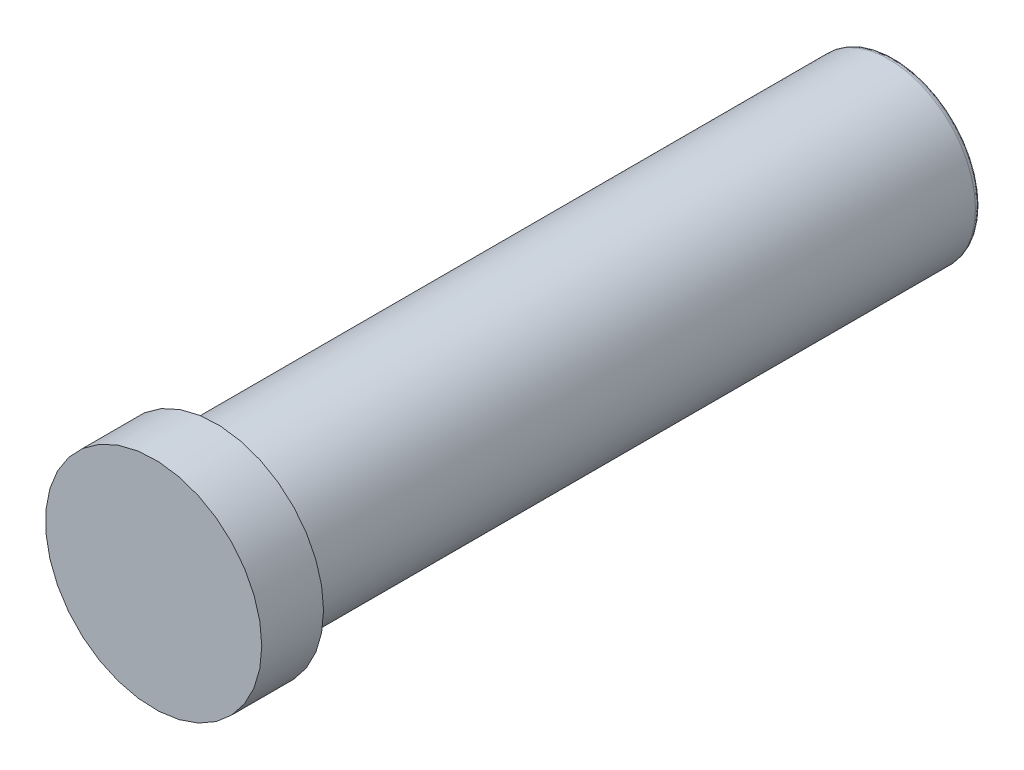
SolidWorks part; units mm, degrees
ref_plane "Front Plane" through (0, 0, 0) normal (0, 0, 1) x (1, 0, 0)
ref_plane "Top Plane" through (0, 0, 0) normal (0, 1, 0) x (1, 0, 0)
ref_plane "Right Plane" through (0, 0, 0) normal (1, 0, 0) x (0, 0, -1)
sketch "Sketch1" plane through (0, 0, 0) normal (1, 0, 0) x (0, 0, -1)
  line L0 (0, 0) -> (125, 0) construction
  line L1 (125, 0) -> (125, 13)
  line L2 (124, 14) -> (10, 14)
  line L3 (10, 14) -> (10, 17.5)
  line L4 (10, 17.5) -> (0, 17.5)
  line L5 (0, 17.5) -> (0, 0)
  line L6 (0, 0) -> (125, 0)
  arc A0 (125, 13) -> (124, 14) centre (124, 13) ccw
  dimension "D5" = 1
  dimension "D1" = 28
  dimension "D2" = 35
  dimension "D3" = 10
  dimension "D4" = 115
revolve "Revolve1" add sketch "Sketch1" angle 360 about L0
hole_wizard "M6 Tapped Hole1" positions "Sketch5" profile "Sketch4" tap size "M6" standard "AS"
sketch "Sketch5" plane through (0, 0, -125) normal (0, 0, -1) x (-1, 0, 0)
  point P0 (0, 0)
sketch "Sketch4" plane through (0, 0, -125) normal (1, 0, 0) x (0, 1, 0)
  line L0 (0, 0) -> (0, 9.5022)
  line L1 (0, 9.5022) -> (2.5, 8)
  line L2 (2.5, 8) -> (2.5, 0.525)
  line L3 (2.5, 0.525) -> (3.025, 0)
  line L5 (3.025, 0) -> (0, 0)
  line L6 (-2.5, 0.525) -> (-3.025, 0) construction
  line L10 (0, 9.5022) -> (-2.5, 8) construction
  line L11 (0, -6.35) -> (0, 107.95) construction
  dimension "Tap Drill Dia." = 5
  dimension "Tap Drill Depth" = 8
  dimension "Near C'Sink Dia." = 6.05
  dimension "Near C'Sink Angle" = 90
  dimension "Drill Angle" = 118
